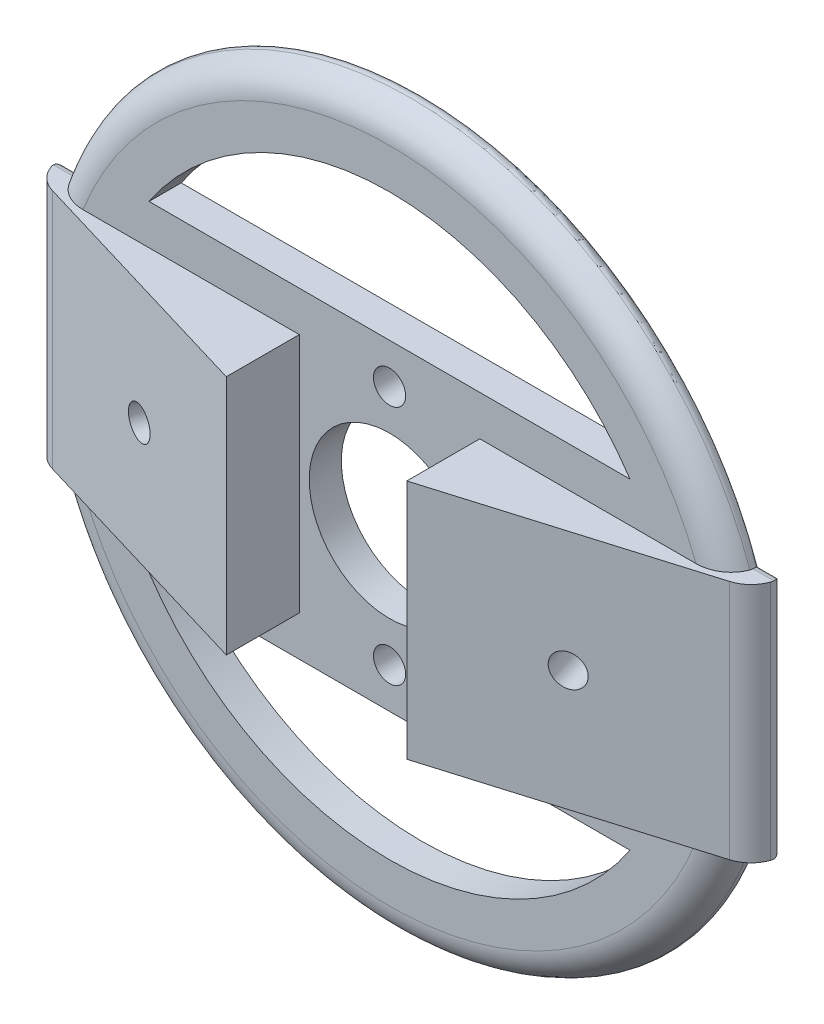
SolidWorks part; units mm, degrees
ref_plane "前视基准面" through (0, 0, 0) normal (0, 0, 1) x (1, 0, 0)
ref_plane "上视基准面" through (0, 0, 0) normal (0, 1, 0) x (1, 0, 0)
ref_plane "右视基准面" through (0, 0, 0) normal (1, 0, 0) x (0, 0, -1)
sketch "草图1" plane through (0, 0, 0) normal (0, 0, 1) x (1, 0, 0)
  circle A0 centre (0, 0) radius 45
  dimension "D1" = 90
extrude "凸台-拉伸1" add sketch "草图1" along normal blind 4
fillet "圆角1" radius 4 1 edges at (45, 0, 4)
sketch "草图2" plane through (0, 0, 4) normal (0, 0, 1) x (1, 0, 0)
  circle A0 centre (0, -15) radius 2 construction
  circle A1 centre (0, 15) radius 2 construction
  circle A2 centre (0, -15) radius 2
  circle A3 centre (0, 15) radius 2
extrude "切除-拉伸1" cut sketch "草图2" against normal blind 4
sketch "草图3" plane through (0, 0, 4) normal (0, 0, 1) x (1, 0, 0)
  line L0 (0, -41) -> (0, 41) construction
  circle A0 centre (0, 0) radius 41 construction
  circle A1 centre (27.5539, 0) radius 15
  circle A2 centre (-27.5539, 0) radius 15
sketch "草图4" plane through (0, 0, 0) normal (0, 1, 0) x (1, 0, 0)
  line L0 (42.1468, -3.8321) -> (11.2331, -13.0835)
  line L1 (45, 0) -> (11.2331, 0)
  line L2 (11.2331, -13.0835) -> (11.2331, -4)
  line L3 (-41, -4) -> (41, -4) construction
  line L4 (45, 0) -> (-45, 0) construction
  line L5 (11.2331, 0) -> (11.2331, -4)
  arc A0 (41, -4) -> (45, 0) centre (41, 0) ccw construction
  arc A1 (42.1468, -3.8321) -> (45, 0) centre (41, 0) ccw
extrude "凸台-拉伸2" add sketch "草图4" along normal mid plane 30
sketch "草图5" plane through (4.5169, 0, 15.0934) normal (0.2867, 0, 0.958) x (0.958, 0, -0.2867)
  circle A0 centre (23.1447, 0) radius 15 construction
  circle A1 centre (23.1447, 0) radius 2
  dimension "D1" = 4
extrude "切除-拉伸2" cut sketch "草图5" against normal blind 30
mirror "镜向1" [suppressed] about plane through (0, 0, 0) normal (1, 0, 0)
sketch "草图7" plane through (0, 0, 0) normal (0, 1, 0) x (1, 0, 0)
  line L0 (11.2331, -4) -> (11.2331, -23.3602)
  line L1 (45, 0) -> (45, -15.2037)
  line L3 (-41, -4) -> (38.1576, -4) construction
  line L4 (42.4264, 0) -> (45, 0)
  line L5 (0, 6.8473) -> (0, -30.9719) construction
  line L6 (-41, -4) -> (38.1576, -4)
  arc A0 (11.2331, -23.3602) -> (45, -15.2037) centre (0, 97.1173) ccw
  spline S0 degree 3 poles (-211.8223, -967.1343) (-1.4392, 38.7255) (44.7416, 10.1744) (42.2812, -1.0719) (42.196, -1.3278) (41.9705, -1.8234) (41.8321, -2.0581) (41.5125, -2.4928) (41.3284, -2.6963) (40.9267, -3.0605) (40.7101, -3.2212) (40.2468, -3.5015) (39.9993, -3.6206) (39.4939, -3.8094) (39.2335, -3.8805) (22.0901, -6.9474) (-6.0882, 86.5788) (1033.6221, 91.0464) knots -5.07479 -5.07479 -5.07479 -5.07479 0.125 0.125 0.25 0.25 0.375 0.375 0.5 0.5 0.625 0.625 0.75 0.75 0.875 0.875 8.74794 8.74794 8.74794 8.74794 only from (42.4264, 0) to (38.1576, -4) construction
  spline S1 degree 3 poles (42.4264, 0) (42.4264, -0.2697) (42.3967, -0.5439) (42.2812, -1.0719) (42.196, -1.3278) (41.9705, -1.8234) (41.8321, -2.0581) (41.5125, -2.4928) (41.3284, -2.6963) (40.9267, -3.0605) (40.7101, -3.2212) (40.2468, -3.5015) (39.9993, -3.6206) (39.4939, -3.8094) (39.2335, -3.8805) (38.6977, -3.9764) (38.4269, -4) (38.1576, -4) knots 0 0 0 0 0.125 0.125 0.25 0.25 0.375 0.375 0.5 0.5 0.625 0.625 0.75 0.75 0.875 0.875 1 1 1 1
revolve "旋转1" [suppressed] add sketch "草图7" angle 180 about L5
sketch "草图8" plane through (4.5169, 0, 15.0934) normal (0.2867, 0, 0.958) x (0.958, 0, -0.2867)
  circle A0 centre (23.1447, 0) radius 12.5
extrude "切除-拉伸4" [suppressed] cut sketch "草图8" along normal up to surface (11.9532 mm away)
mirror "镜向2" [suppressed] about plane through (0, 0, 0) normal (1, 0, 0)
sketch "草图10" [suppressed] plane through (4.5169, 0, 15.0934) normal (0.2867, 0, 0.958) x (0.958, 0, -0.2867)
  line L0 (21.1447, 0) -> (25.1447, 0) construction
  circle A0 centre (23.1447, 0) radius 2
extrude "切除-拉伸5" [suppressed] cut sketch "草图10" against normal blind 10
mirror "镜向3" [suppressed] about plane through (0, 0, 0) normal (1, 0, 0)
sketch "草图11" plane through (0, 0, 4) normal (0, 0, 1) x (1, 0, 0)
  circle A0 centre (0, 15) radius 5
extrude "切除-拉伸6" [suppressed] cut sketch "草图11" along normal blind 39
mirror "镜向6" [suppressed]
fillet "圆角2" [suppressed] radius 4
mirror "镜向7" about plane through (0, 0, 0) normal (1, 0, 0) of "切除-拉伸2", "凸台-拉伸2"
sketch "草图12" plane through (0, 0, 4) normal (0, 0, 1) x (1, 0, 0)
  line L6 (-6.2331, 20) -> (6.2331, 20)
  line L7 (-6.2331, -20) -> (6.2331, -20)
  line L12 (-29.9333, 20) -> (-6.2331, 20)
  line L13 (-6.2331, 20) -> (-6.2331, -20)
  line L14 (-6.2331, -20) -> (-29.9333, -20)
  line L15 (29.9333, -20) -> (6.2331, -20)
  line L16 (6.2331, -20) -> (6.2331, 20)
  line L17 (6.2331, 20) -> (29.9333, 20)
  line L18 (-29.9333, 20) -> (-6.2331, 20)
  line L20 (-6.2331, -20) -> (-29.9333, -20)
  line L21 (29.9333, -20) -> (6.2331, -20)
  line L23 (6.2331, 20) -> (29.9333, 20)
  circle A2 centre (0, 0) radius 10
  arc A4 (-29.9333, -20) -> (29.9333, -20) centre (0, 0) ccw
  arc A5 (29.9333, 20) -> (-29.9333, 20) centre (0, 0) ccw
  arc A6 (-29.9333, -20) -> (29.9333, -20) centre (0, 0) ccw
  arc A7 (29.9333, 20) -> (-29.9333, 20) centre (0, 0) ccw
  dimension "D2" = 20
  dimension "D1" = 5
extrude "切除-拉伸7" cut sketch "草图12" against normal blind 10
fillet "圆角3" radius 1 8 edges at (0, -45, 0) (0, 45, 0) (-43.7132, 15, 0) (-45, 0, 0) (-43.7132, -15, 0) (43.7132, -15, 0) (45, 0, 0) (43.7132, 15, 0)
